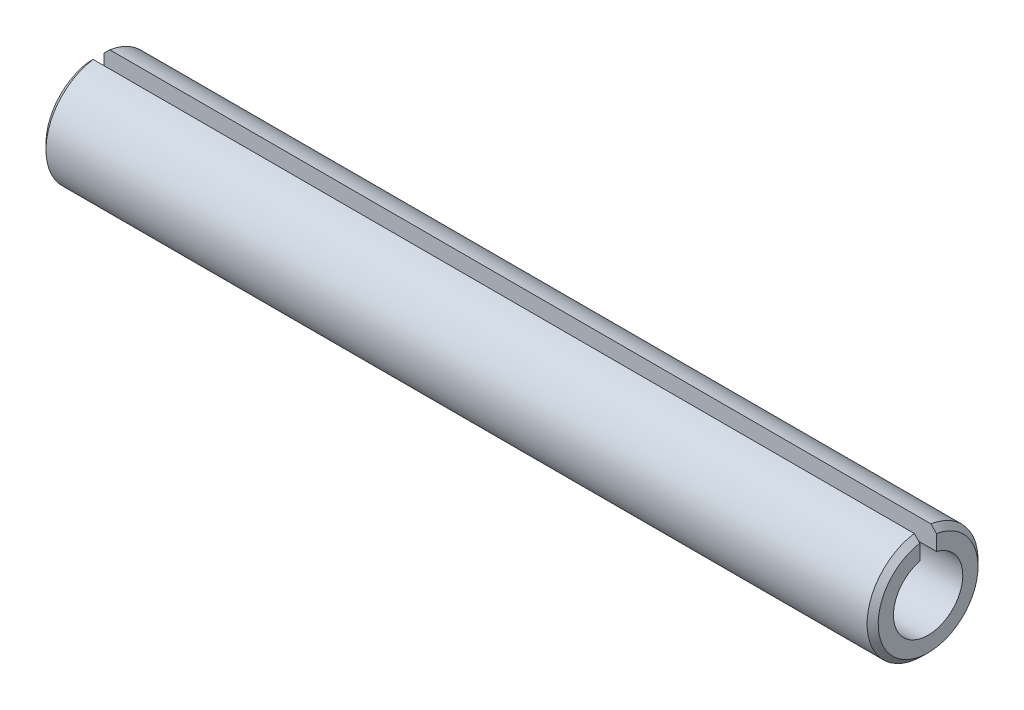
SolidWorks part; units mm, degrees
ref_plane "Plan1" through (0, 0, 0) normal (0, 0, 1) x (1, 0, 0)
ref_plane "Plan2" through (0, 0, 0) normal (0, 1, 0) x (1, 0, 0)
ref_plane "Plan3" through (0, 0, 0) normal (1, 0, 0) x (0, 0, -1)
sketch "Esquisse1" plane through (0, 0, 0) normal (0, 0, 1) x (1, 0, 0)
  line L0 (0, 2.5) -> (0, 3.6)
  line L1 (0, 2.5) -> (60, 2.5)
  line L2 (60, 2.5) -> (60, 3.6)
  line L3 (60, 3.6) -> (59.6, 4)
  line L4 (59.6, 4) -> (0.4, 4)
  line L5 (0.4, 4) -> (0, 3.6)
  line L6 (0, 0) -> (60, 0) construction
  dimension "D1" = 60
  dimension "D2" = 4
  dimension "D3" = 1.5
  dimension "D4" = 45
  dimension "D5" = 45
  dimension "D6" = 0.4
revolve "Base-Révolution" add sketch "Esquisse1" angle 360 about L6
sketch "Esquisse2" plane through (0, 0, 0) normal (1, 0, 0) x (0, 0, -1)
  line L0 (0, 0) -> (0, 4) construction
  line L1 (0.6, 3.9547) -> (0.6, 2.4269)
  line L2 (-0.6, 3.9547) -> (-0.6, 2.4269)
  circle A0 centre (0, 0) radius 4 construction
  circle A1 centre (0, 0) radius 2.5 construction
  arc A2 (0.6, 2.4269) -> (-0.6, 2.4269) centre (0, 0) ccw
  arc A3 (0.6, 3.9547) -> (-0.6, 3.9547) centre (0, 0) ccw
  dimension "D1" = 0.6
extrude "Enlèv. mat.-Extru.2" cut sketch "Esquisse2" along normal through all
equation "\"D6@Esquisse1\"=\"D2@Esquisse1\"/10"
equation "\"D1@Esquisse2\"=\"D3@Esquisse1\"/2.5"
